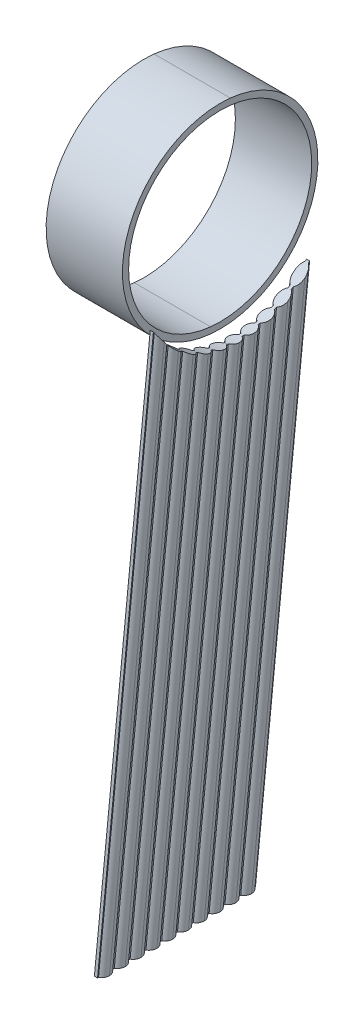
SolidWorks part; units mm, degrees
ref_plane "Front" through (0, 0, 0) normal (0, 0, 1) x (1, 0, 0)
ref_plane "Top" through (0, 0, 0) normal (0, 1, 0) x (1, 0, 0)
ref_plane "Right" through (0, 0, 0) normal (1, 0, 0) x (0, 0, -1)
imported_body "Importée1"
imported_body "Importée2"
sketch "Esquisse1" plane through (76, 0, 0) normal (-1, 0, 0) x (0, 0, 1)
  line L1 (-5.0538, -46.971) -> (16.2684, -46.971)
  line L2 (-5.0538, -46.971) -> (-5.0538, -59.1551)
  line L3 (-5.0538, -59.1551) -> (16.2684, -59.1551)
  line L4 (16.2684, -46.971) -> (16.2684, -59.1551)
extrude "Enlèv. mat.-Extru.1" cut sketch "Esquisse1" against normal through all
